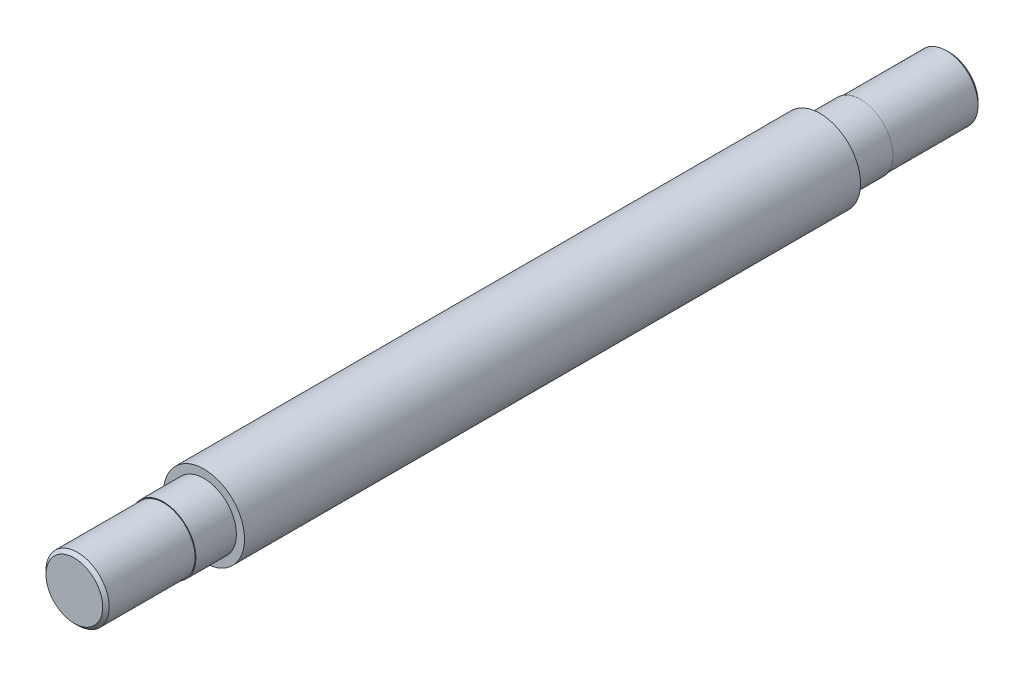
SolidWorks part; units mm, degrees
ref_plane "前视基准面" through (0, 0, 0) normal (0, 0, 1) x (1, 0, 0)
ref_plane "上视基准面" through (0, 0, 0) normal (0, 1, 0) x (1, 0, 0)
ref_plane "右视基准面" through (0, 0, 0) normal (1, 0, 0) x (0, 0, -1)
sketch "草图1" plane through (0, 0, 0) normal (0, 0, 1) x (1, 0, 0)
  circle A0 centre (0, 0) radius 25
extrude "凸台-拉伸1" add sketch "草图1" along normal blind 380
sketch "草图2" plane through (0, 0, 380) normal (0, 0, 1) x (1, 0, 0)
  circle A0 centre (0, 0) radius 20
extrude "凸台-拉伸2" add sketch "草图2" along normal blind 25
sketch "草图3" plane through (0, 0, 0) normal (0, 0, -1) x (-1, 0, 0)
  circle A0 centre (0, 0) radius 20
extrude "凸台-拉伸3" add sketch "草图3" along normal blind 25
sketch "草图4" plane through (0, 0, 405) normal (0, 0, 1) x (1, 0, 0)
  circle A0 centre (0, 0) radius 19.5
extrude "凸台-拉伸4" add sketch "草图4" along normal blind 55
sketch "草图5" plane through (0, 0, -25) normal (0, 0, -1) x (-1, 0, 0)
  circle A0 centre (0, 0) radius 19.5
extrude "凸台-拉伸5" add sketch "草图5" along normal blind 55
chamfer "倒角1" distance 2 angle 45 2 edges at (-19.5, 0, -80) (19.5, 0, 460)
